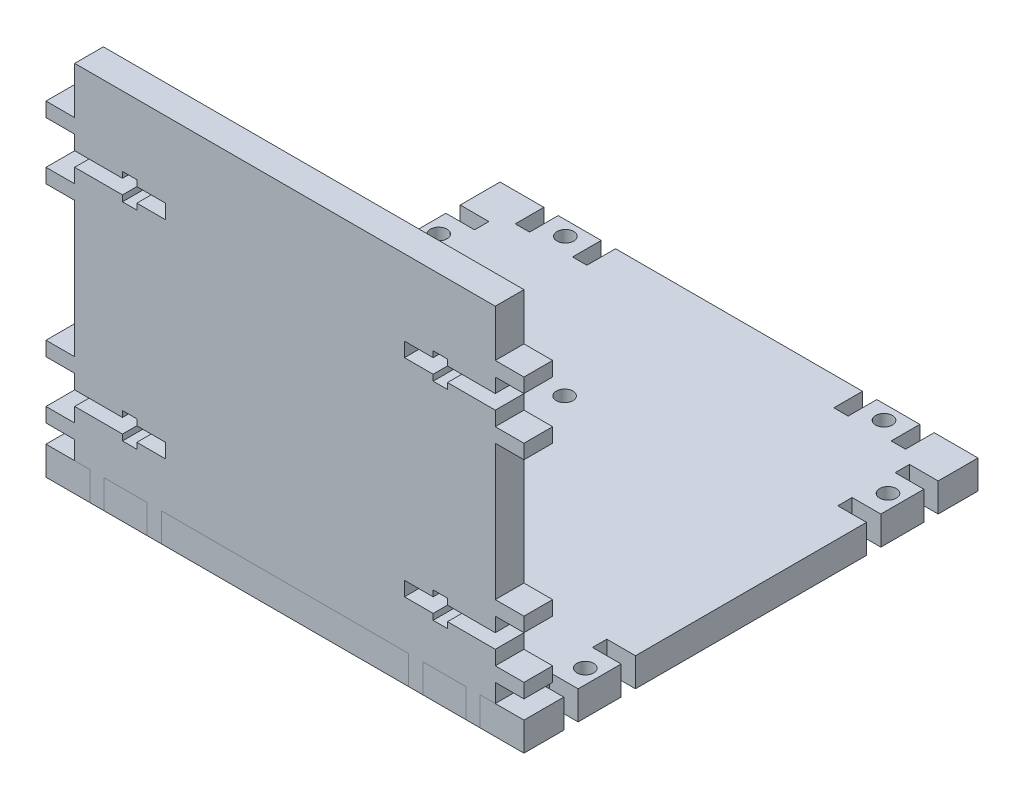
SolidWorks part; units mm, degrees
ref_plane "Front Plane" through (0, 0, 0) normal (0, 0, 1) x (1, 0, 0)
ref_plane "Top Plane" through (0, 0, 0) normal (0, 1, 0) x (1, 0, 0)
ref_plane "Right Plane" through (0, 0, 0) normal (1, 0, 0) x (0, 0, -1)
sketch "Sketch1" plane through (0, 0, 0) normal (0, 1, 0) x (1, 0, 0)
  line L1 (-50, -47.5) -> (50, -47.5)
  line L2 (-50, -47.5) -> (-50, 47.5)
  line L3 (-50, 47.5) -> (50, 47.5)
  line L4 (50, -47.5) -> (50, 47.5)
  line L5 (-50, -47.5) -> (50, 47.5) construction
  line L6 (-50, 47.5) -> (50, -47.5) construction
  point P0 (0, 0)
  dimension "D1" = 100
  dimension "D2" = 95
extrude "Boss-Extrude1" add sketch "Sketch1" along normal blind 6
sketch "Sketch2" plane through (0, 6, 0) normal (0, 1, 0) x (1, 0, 0)
  line L0 (50, 44.5) -> (-50, 44.5) construction
  line L1 (-50, -44.5) -> (50, -44.5) construction
  line L2 (-47, 47.5) -> (-47, -47.5) construction
  line L3 (50, 41.5) -> (-50, 41.5) construction
  line L4 (47, -47.5) -> (47, 47.5) construction
  line L5 (-44, 47.5) -> (-44, -47.5) construction
  line L6 (44, -47.5) -> (44, 47.5) construction
  line L7 (-50, -41.5) -> (50, -41.5) construction
  line L12 (50, -47.5) -> (50, 47.5)
  line L13 (50, 47.5) -> (-50, 47.5)
  line L14 (-50, 47.5) -> (-50, -47.5)
  line L15 (-50, -47.5) -> (50, -47.5)
  line L16 (50, -47.5) -> (50, 47.5) construction
  line L17 (50, 47.5) -> (-50, 47.5) construction
  line L18 (-50, 47.5) -> (-50, -47.5) construction
  line L19 (-50, -47.5) -> (50, -47.5) construction
  line L21 (-50, 39.1667) -> (-44, 39.1667)
  line L22 (-50, 39.1667) -> (-50, 36.1667)
  line L23 (-50, 36.1667) -> (-44, 36.1667)
  line L24 (-44, 39.1667) -> (-44, 36.1667)
  line L25 (-33.3333, 44.5) -> (-33.3333, 41.5) construction
  line L26 (-40.8333, 41.5) -> (-37.8333, 41.5)
  line L27 (-40.8333, 41.5) -> (-40.8333, 47.5)
  line L28 (-40.8333, 47.5) -> (-37.8333, 47.5)
  line L29 (-37.8333, 41.5) -> (-37.8333, 47.5)
  line L30 (-47, 31.6667) -> (-44, 31.6667) construction
  line L31 (0, 47.5) -> (0, 0) construction
  line L32 (0, 0) -> (-50, 0) construction
  line L33 (-25.8333, 47.5) -> (-28.8333, 47.5)
  line L34 (-28.8333, 41.5) -> (-28.8333, 47.5)
  line L35 (-25.8333, 41.5) -> (-28.8333, 41.5)
  line L36 (-25.8333, 41.5) -> (-25.8333, 47.5)
  line L37 (-50, 27.1667) -> (-44, 27.1667)
  line L38 (-44, 24.1667) -> (-44, 27.1667)
  line L39 (-50, 24.1667) -> (-44, 24.1667)
  line L40 (-50, 24.1667) -> (-50, 27.1667)
  line L41 (50, 24.1667) -> (50, 27.1667)
  line L42 (50, 24.1667) -> (44, 24.1667)
  line L43 (44, 24.1667) -> (44, 27.1667)
  line L44 (50, 27.1667) -> (44, 27.1667)
  line L45 (50, 36.1667) -> (44, 36.1667)
  line L46 (44, 39.1667) -> (44, 36.1667)
  line L47 (50, 39.1667) -> (44, 39.1667)
  line L48 (50, 39.1667) -> (50, 36.1667)
  line L49 (40.8333, 47.5) -> (37.8333, 47.5)
  line L50 (37.8333, 41.5) -> (37.8333, 47.5)
  line L51 (40.8333, 41.5) -> (37.8333, 41.5)
  line L52 (40.8333, 41.5) -> (40.8333, 47.5)
  line L53 (25.8333, 41.5) -> (25.8333, 47.5)
  line L54 (25.8333, 41.5) -> (28.8333, 41.5)
  line L55 (28.8333, 41.5) -> (28.8333, 47.5)
  line L56 (25.8333, 47.5) -> (28.8333, 47.5)
  line L57 (50, -24.1667) -> (44, -24.1667)
  line L58 (44, -24.1667) -> (44, -27.1667)
  line L59 (50, -27.1667) -> (44, -27.1667)
  line L60 (50, -24.1667) -> (50, -27.1667)
  line L61 (50, -39.1667) -> (50, -36.1667)
  line L62 (50, -39.1667) -> (44, -39.1667)
  line L63 (44, -39.1667) -> (44, -36.1667)
  line L64 (50, -36.1667) -> (44, -36.1667)
  line L65 (40.8333, -41.5) -> (40.8333, -47.5)
  line L66 (40.8333, -41.5) -> (37.8333, -41.5)
  line L67 (37.8333, -41.5) -> (37.8333, -47.5)
  line L68 (40.8333, -47.5) -> (37.8333, -47.5)
  line L69 (25.8333, -41.5) -> (28.8333, -41.5)
  line L70 (28.8333, -41.5) -> (28.8333, -47.5)
  line L71 (25.8333, -47.5) -> (28.8333, -47.5)
  line L72 (25.8333, -41.5) -> (25.8333, -47.5)
  line L73 (-50, -24.1667) -> (-50, -27.1667)
  line L74 (-50, -24.1667) -> (-44, -24.1667)
  line L75 (-44, -24.1667) -> (-44, -27.1667)
  line L76 (-50, -27.1667) -> (-44, -27.1667)
  line L77 (-50, -36.1667) -> (-44, -36.1667)
  line L78 (-44, -39.1667) -> (-44, -36.1667)
  line L79 (-50, -39.1667) -> (-44, -39.1667)
  line L80 (-50, -39.1667) -> (-50, -36.1667)
  line L81 (-40.8333, -47.5) -> (-37.8333, -47.5)
  line L82 (-37.8333, -41.5) -> (-37.8333, -47.5)
  line L83 (-40.8333, -41.5) -> (-37.8333, -41.5)
  line L84 (-40.8333, -41.5) -> (-40.8333, -47.5)
  line L85 (-25.8333, -41.5) -> (-25.8333, -47.5)
  line L86 (-25.8333, -41.5) -> (-28.8333, -41.5)
  line L87 (-28.8333, -41.5) -> (-28.8333, -47.5)
  line L88 (-25.8333, -47.5) -> (-28.8333, -47.5)
  circle A0 centre (-33.3333, 44.5) radius 1.75
  circle A1 centre (-47, 31.6667) radius 1.75
  circle A2 centre (47, 31.6667) radius 1.75
  circle A3 centre (33.3333, 44.5) radius 1.75
  circle A4 centre (47, -31.6667) radius 1.75
  circle A5 centre (33.3333, -44.5) radius 1.75
  circle A6 centre (-47, -31.6667) radius 1.75
  circle A7 centre (-33.3333, -44.5) radius 1.75
  point P38 (-39.3333, 41.5)
  point P39 (-44, 37.6667)
extrude "Cut-Extrude1" cut sketch "Sketch2" against normal through all
sketch "Sketch3" plane through (0, 6, 0) normal (0, 1, 0) x (1, 0, 0)
  line L0 (0, 0) -> (-20, 0) construction
  line L2 (-35.5, -15.5) -> (-4.5, -15.5) construction
  line L3 (-35.5, -15.5) -> (-35.5, 15.5) construction
  line L4 (-35.5, 15.5) -> (-4.5, 15.5) construction
  line L5 (-4.5, -15.5) -> (-4.5, 15.5) construction
  line L6 (-35.5, -15.5) -> (-4.5, 15.5) construction
  line L7 (-35.5, 15.5) -> (-4.5, -15.5) construction
  circle A0 centre (-20, 0) radius 11.5
  circle A1 centre (-4.5, 15.5) radius 1.75
  circle A2 centre (-35.5, 15.5) radius 1.75
  circle A3 centre (-35.5, -15.5) radius 1.75
  circle A4 centre (-4.5, -15.5) radius 1.75
  dimension "D1" = 31
  dimension "D2" = 23
  dimension "D4" = 3.5
  dimension "D3" = 20
extrude "Cut-Extrude2" cut sketch "Sketch3" against normal through all
sketch "Sketch4" plane through (0, 0, 41.5) normal (0, 0, 1) x (1, 0, 0)
  line L0 (40.8333, 0) -> (40.8333, 6) construction
  line L1 (40.8333, 0) -> (37.8333, 0) construction
  line L2 (37.8333, 0) -> (37.8333, 6) construction
  line L3 (28.8333, 0) -> (28.8333, 6) construction
  line L4 (28.8333, 0) -> (25.8333, 0) construction
  line L5 (25.8333, 0) -> (25.8333, 6) construction
  line L6 (-25.8333, 0) -> (-25.8333, 6) construction
  line L7 (-25.8333, 0) -> (-28.8333, 0) construction
  line L8 (-28.8333, 0) -> (-28.8333, 6) construction
  line L9 (-37.8333, 0) -> (-37.8333, 6) construction
  line L10 (-37.8333, 0) -> (-40.8333, 0) construction
  line L11 (-40.8333, 0) -> (-40.8333, 6) construction
  line L12 (40.8333, 0) -> (40.8333, 6)
  line L13 (40.8333, 0) -> (37.8333, 0)
  line L14 (37.8333, 0) -> (37.8333, 6)
  line L15 (28.8333, 0) -> (28.8333, 6)
  line L16 (28.8333, 0) -> (25.8333, 0)
  line L17 (25.8333, 0) -> (25.8333, 6)
  line L18 (-25.8333, 0) -> (-25.8333, 6)
  line L19 (-25.8333, 0) -> (-28.8333, 0)
  line L20 (-28.8333, 0) -> (-28.8333, 6)
  line L21 (-37.8333, 0) -> (-37.8333, 6)
  line L22 (-37.8333, 0) -> (-40.8333, 0)
  line L23 (-40.8333, 0) -> (-40.8333, 6)
  line L24 (-40.8333, 6) -> (-44, 6)
  line L25 (-50, 6) -> (-40.8333, 6) construction
  line L26 (40.8333, 6) -> (44, 6)
  line L27 (40.8333, 6) -> (50, 6) construction
  line L29 (28.8333, 6) -> (37.8333, 6) construction
  line L30 (-25.8333, 6) -> (25.8333, 6) construction
  line L31 (-37.8333, 6) -> (-28.8333, 6) construction
  line L32 (28.8333, 6) -> (37.8333, 6)
  line L33 (-25.8333, 6) -> (25.8333, 6)
  line L34 (-37.8333, 6) -> (-28.8333, 6)
  line L35 (-44, 6) -> (-44, 78)
  line L36 (-44, 78) -> (44, 78)
  line L37 (44, 78) -> (44, 6)
  dimension "D1" = 6
  dimension "D2" = 78
extrude "Boss-Extrude2" add sketch "Sketch4" along normal blind 6 separate body
sketch "Sketch5" plane through (0, 0, 47.5) normal (0, 0, 1) x (1, 0, 0)
  line L0 (-44, 78) -> (-50, 78) construction
  line L1 (-50, 78) -> (-50, 0) construction
  line L2 (-50, 0) -> (-40.8333, 0) construction
  line L3 (-50, 60.6667) -> (-44, 60.6667) construction
  line L4 (-44, 78) -> (-44, 6) construction
  line L5 (-50, 39) -> (44, 39) construction
  line L6 (-50, 68.1667) -> (-44, 68.1667)
  line L7 (-50, 68.1667) -> (-50, 65.1667)
  line L8 (-50, 65.1667) -> (-44, 65.1667)
  line L9 (-44, 68.1667) -> (-44, 65.1667)
  line L10 (0, 0) -> (0, 78) construction
  line L11 (44, 78) -> (-44, 78) construction
  line L12 (-50, 56.1667) -> (-44, 56.1667)
  line L13 (-44, 53.1667) -> (-44, 56.1667)
  line L14 (-50, 53.1667) -> (-44, 53.1667)
  line L15 (-50, 53.1667) -> (-50, 56.1667)
  line L16 (44, 6) -> (44, 78) construction
  line L17 (-50, 24.8333) -> (-50, 21.8333)
  line L18 (-50, 24.8333) -> (-44, 24.8333)
  line L19 (-44, 24.8333) -> (-44, 21.8333)
  line L20 (-50, 21.8333) -> (-44, 21.8333)
  line L21 (-50, 12.8333) -> (-44, 12.8333)
  line L22 (-44, 9.8333) -> (-44, 12.8333)
  line L23 (-50, 9.8333) -> (-44, 9.8333)
  line L24 (-50, 9.8333) -> (-50, 12.8333)
  line L25 (50, 9.8333) -> (50, 12.8333)
  line L26 (50, 9.8333) -> (44, 9.8333)
  line L27 (44, 9.8333) -> (44, 12.8333)
  line L28 (50, 12.8333) -> (44, 12.8333)
  line L29 (50, 24.8333) -> (44, 24.8333)
  line L30 (44, 24.8333) -> (44, 21.8333)
  line L31 (50, 21.8333) -> (44, 21.8333)
  line L32 (50, 24.8333) -> (50, 21.8333)
  line L33 (50, 53.1667) -> (50, 56.1667)
  line L34 (50, 53.1667) -> (44, 53.1667)
  line L35 (44, 53.1667) -> (44, 56.1667)
  line L36 (50, 56.1667) -> (44, 56.1667)
  line L37 (50, 65.1667) -> (44, 65.1667)
  line L38 (44, 68.1667) -> (44, 65.1667)
  line L39 (50, 68.1667) -> (44, 68.1667)
  line L40 (50, 68.1667) -> (50, 65.1667)
  point P14 (-44, 66.6667)
extrude "Boss-Extrude4" add sketch "Sketch5" against normal up to surface (6 mm away)
sketch "Sketch6" plane through (0, 0, 47.5) normal (0, 0, 1) x (1, 0, 0)
  line L0 (-44, 78) -> (-50, 78) construction
  line L1 (-50, 78) -> (-50, 0) construction
  line L2 (-50, 0) -> (-40.8333, 0) construction
  line L3 (-50, 39) -> (44, 39) construction
  line L4 (44, 24.8333) -> (44, 53.1667) construction
  line L5 (0, 0) -> (0, 78) construction
  line L6 (44, 78) -> (-44, 78) construction
  line L7 (-44, 60.6667) -> (-25, 60.6667) construction
  line L8 (-44, 62.1667) -> (-34, 62.1667)
  line L9 (-44, 62.1667) -> (-44, 59.1667)
  line L10 (-44, 59.1667) -> (-34, 59.1667)
  line L12 (-34, 63.4226) -> (-31, 63.4226)
  line L13 (-34, 63.4226) -> (-34, 62.1667)
  line L14 (-34, 57.9108) -> (-31, 57.9108)
  line L15 (-31, 63.4226) -> (-31, 62.1667)
  line L16 (-31, 62.1667) -> (-25, 62.1667)
  line L18 (-31, 59.1667) -> (-25, 59.1667)
  line L19 (-25, 62.1667) -> (-25, 59.1667)
  line L20 (-44, 65.1667) -> (-44, 56.1667) construction
  line L21 (-34, 59.1667) -> (-34, 57.9108)
  line L22 (-31, 59.1667) -> (-31, 57.9108)
  line L23 (31, 59.1667) -> (25, 59.1667)
  line L24 (25, 62.1667) -> (25, 59.1667)
  line L25 (31, 62.1667) -> (25, 62.1667)
  line L26 (31, 63.4226) -> (31, 62.1667)
  line L27 (34, 63.4226) -> (31, 63.4226)
  line L28 (34, 63.4226) -> (34, 62.1667)
  line L29 (44, 62.1667) -> (34, 62.1667)
  line L30 (44, 62.1667) -> (44, 59.1667)
  line L31 (44, 59.1667) -> (34, 59.1667)
  line L32 (34, 59.1667) -> (34, 57.9108)
  line L33 (34, 57.9108) -> (31, 57.9108)
  line L34 (31, 59.1667) -> (31, 57.9108)
  line L35 (-31, 18.8333) -> (-25, 18.8333)
  line L36 (-25, 15.8333) -> (-25, 18.8333)
  line L37 (-31, 15.8333) -> (-25, 15.8333)
  line L38 (-31, 14.5774) -> (-31, 15.8333)
  line L39 (-34, 14.5774) -> (-31, 14.5774)
  line L40 (-34, 14.5774) -> (-34, 15.8333)
  line L41 (-44, 15.8333) -> (-34, 15.8333)
  line L42 (-44, 15.8333) -> (-44, 18.8333)
  line L43 (-44, 18.8333) -> (-34, 18.8333)
  line L44 (-34, 18.8333) -> (-34, 20.0892)
  line L45 (-34, 20.0892) -> (-31, 20.0892)
  line L46 (-31, 18.8333) -> (-31, 20.0892)
  line L47 (31, 18.8333) -> (31, 20.0892)
  line L48 (34, 20.0892) -> (31, 20.0892)
  line L49 (34, 18.8333) -> (34, 20.0892)
  line L50 (44, 18.8333) -> (34, 18.8333)
  line L51 (44, 15.8333) -> (44, 18.8333)
  line L52 (44, 15.8333) -> (34, 15.8333)
  line L53 (34, 14.5774) -> (34, 15.8333)
  line L54 (34, 14.5774) -> (31, 14.5774)
  line L55 (31, 14.5774) -> (31, 15.8333)
  line L56 (31, 15.8333) -> (25, 15.8333)
  line L57 (25, 15.8333) -> (25, 18.8333)
  line L58 (31, 18.8333) -> (25, 18.8333)
  point P27 (-25, 60.6667)
  dimension "D1" = 6
  dimension "D2" = 25
  dimension "D3" = 3
  dimension "D4" = 3
  dimension "D5" = 3
  dimension "D6" = 5.5118
  dimension "D7" = 10
extrude "Cut-Extrude3" cut sketch "Sketch6" against normal through all
equation "\"D14@Sketch2\"=(\"D12@Sketch2\"/3)/2"
equation "\"D16@Sketch2\"=\"D15@Sketch2\""
equation "\"D17@Sketch2\"=(\"D13@Sketch2\"/3)/2"
equation "\"D2@Sketch5\"=(\"D3@Sketch5\"/3)/1.5"
